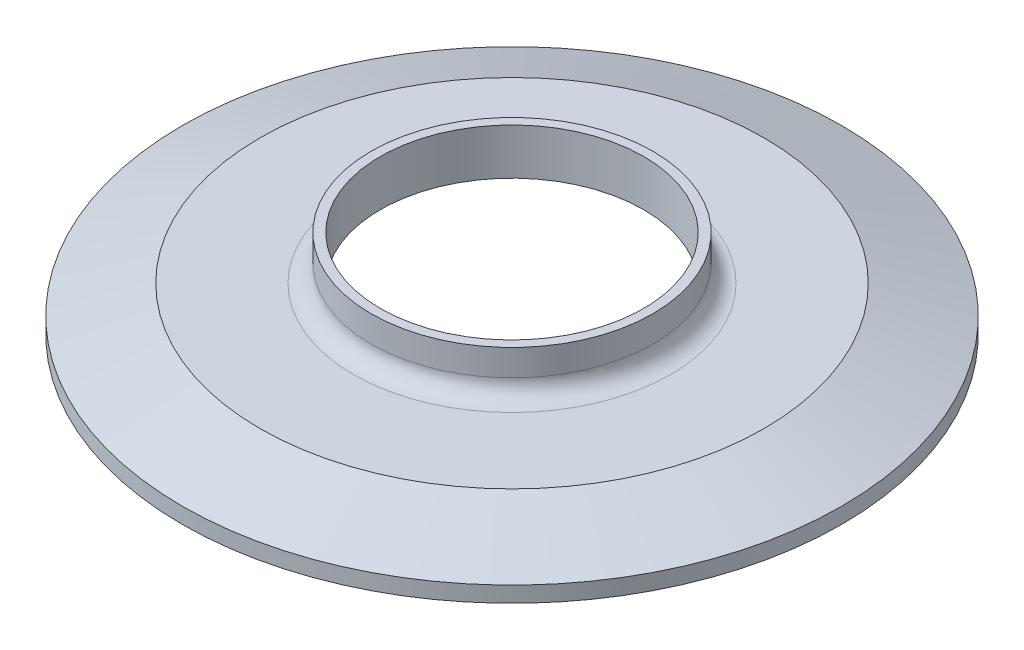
SolidWorks part; units mm, degrees
ref_plane "Front Plane" through (0, 0, 0) normal (0, 0, 1) x (1, 0, 0)
ref_plane "Top Plane" through (0, 0, 0) normal (0, 1, 0) x (1, 0, 0)
ref_plane "Right Plane" through (0, 0, 0) normal (1, 0, 0) x (0, 0, -1)
sketch "Sketch1" plane through (0, 0, 0) normal (0, 0, 1) x (1, 0, 0)
  line L0 (0, 0) -> (0, 8.8532) construction
  line L1 (-25.4, 15.875) -> (-25.4, 11.1252)
  line L2 (-28.575, 7.9502) -> (-45.4344, 7.9502)
  line L3 (-45.4344, 7.9502) -> (-59.4614, 2.8448)
  line L4 (-59.4614, 2.8448) -> (-59.4614, 0)
  line L5 (-59.4614, 0) -> (-56.9249, 0)
  line L6 (-48.6918, 0) -> (-52.8099, 0)
  line L10 (-48.6918, 0) -> (-23.749, 7.5639)
  line L11 (-23.749, 7.5639) -> (-23.749, 15.875)
  line L12 (-23.749, 15.875) -> (-25.4, 15.875)
  line L15 (-55.8994, 0.8729) -> (-56.0708, 0.4691)
  line L17 (-53.7016, 0.8729) -> (-53.5347, 0.4797)
  arc A0 (-28.575, 7.9502) -> (-25.4, 11.1252) centre (-28.575, 11.1252) ccw
  arc A1 (-56.0708, 0.4691) -> (-56.9249, 0) centre (-56.7956, 0.7767) cw
  arc A2 (-52.8099, 0) -> (-53.5347, 0.4797) centre (-52.8099, 0.7874) cw
  arc A3 (-53.7016, 0.8729) -> (-55.8994, 0.8729) centre (-54.8005, 0.4064) ccw
  dimension "D3" = 3.175
  dimension "D7" = 0.7874
  dimension "D8" = 54.8005
  dimension "D9" = 0.7874
  dimension "D15" = 1.1938
  dimension "D2" = 23.749
  dimension "D4" = 15.875
  dimension "D5" = 7.9502
  dimension "D6" = 59.4614
  dimension "D10" = 20
  dimension "D11" = 48.6918
  dimension "D12" = 25.4
  dimension "D13" = 2.8448
  dimension "D14" = 73.13
  dimension "D16" = 0.4064
  dimension "D17" = 46
  dimension "D18" = 2.8448
revolve "Revolve1" add sketch "Sketch1" angle 360 about L0
